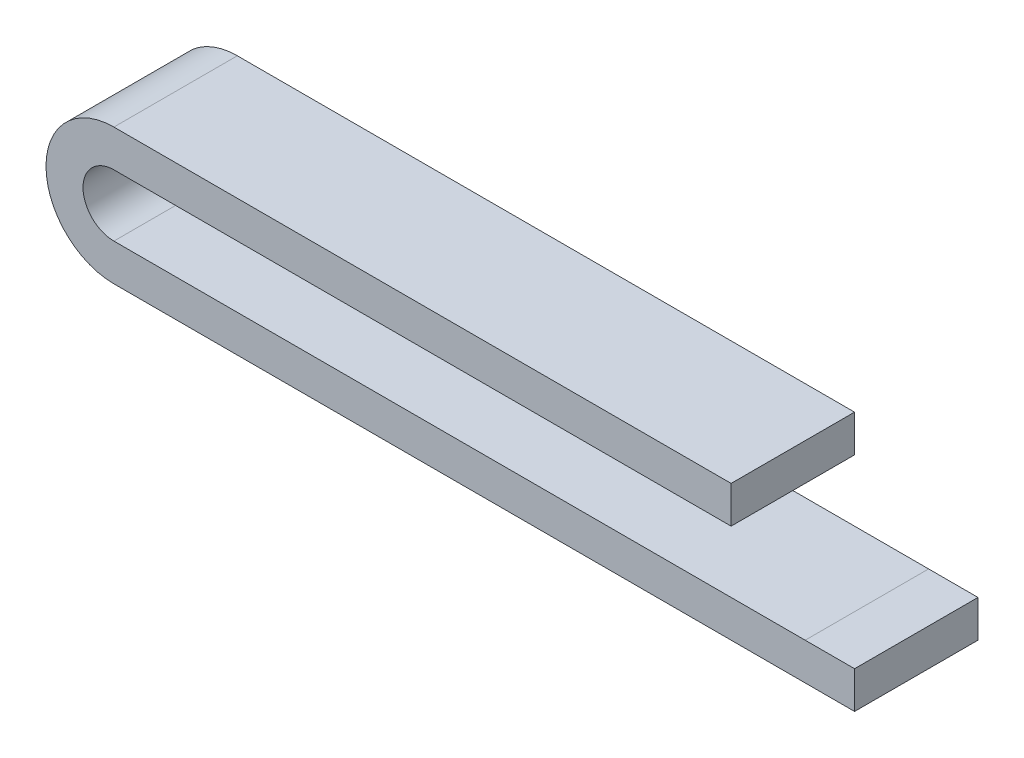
SolidWorks part; units mm, degrees
ref_plane "Front" through (0, 0, 0) normal (0, 0, 1) x (1, 0, 0)
ref_plane "Top" through (0, 0, 0) normal (0, 1, 0) x (1, 0, 0)
ref_plane "Right" through (0, 0, 0) normal (1, 0, 0) x (0, 0, -1)
sketch "Sketch1" plane through (0, 0, 0) normal (0, 0, 1) x (1, 0, 0)
  line L0 (0, 0) -> (30, 0)
  line L1 (0, -33.6031) -> (0, 41.6134) construction
  line L3 (30, -44.9382) -> (30, 41.6134) construction
  line L4 (0, 4) -> (25, 4)
  line L5 (25, 41.6134) -> (25, -44.9382) construction
  arc A0 (0, 4) -> (0, 0) centre (0, 2) ccw
  dimension "D1" = 4
  dimension "D2" = 5
  dimension "D3" = 30
ref_plane "Plane1" through (30, 0, 0) normal (1, 0, 0) x (0, 0, -1)
sketch "Sketch2" plane through (30, 0, 0) normal (1, 0, 0) x (0, 0, -1)
  line L0 (-106.2603, 0) -> (108.8076, 0) construction
  line L1 (0, -44.9382) -> (0, 114.9253) construction
  line L2 (0, -44.9382) -> (0, 41.6134) construction
  line L4 (-2.5, 0.75) -> (2.5, 0.75)
  line L5 (-2.5, 0.75) -> (-2.5, -0.75)
  line L6 (-2.5, -0.75) -> (2.5, -0.75)
  line L7 (2.5, 0.75) -> (2.5, -0.75)
  dimension "D1" = 5
  dimension "D2" = 2.5
  dimension "D3" = 1.5
  dimension "D4" = 0.75
sweep "Base-Sweep" add profiles "Sketch2" path "Sketch1"
sketch "Sketch3" plane through (0, -0.75, 0) normal (0, -1, 0) x (1, 0, 0)
  line L0 (28, 2.5) -> (28, -2.5)
  line L1 (30, 2.5) -> (30, -2.5) construction
  line L2 (0, 2.5) -> (30, 2.5) construction
  line L3 (0, -2.5) -> (30, -2.5) construction
  dimension "D1" = 2
sketch "Sketch4" plane through (0, 0.75, 0) normal (0, 1, 0) x (-1, 0, 0)
  line L0 (-28, -2.5) -> (-28, 2.5) construction
  line L1 (-28, -2.5) -> (-28, 2.5)
